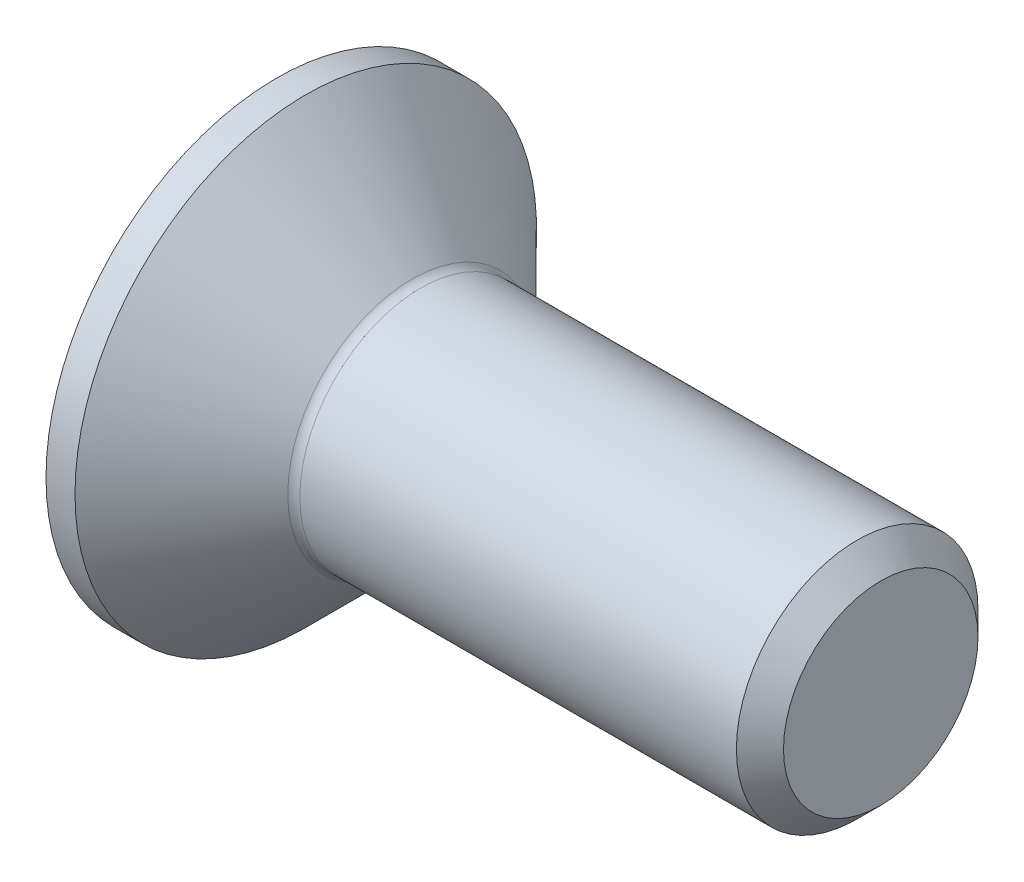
SolidWorks part; units mm, degrees
revolve "PreBroach" cut sketch "Sketch2"
sketch "Sketch2"
  line L0 (0, 1.26) -> (1.8, 1.26)
  line L1 (1.8, 1.26) -> (2.5275, 0)
  line L2 (0, 0) -> (127, 0) construction
  line L3 (2.5275, 0) -> (0, 0)
  line L4 (0, 0) -> (0, 1.26)
  line L5 (0, -1.26) -> (1.8, -1.26) construction
  line L6 (0, 0) -> (47.625, 0) construction
  line L8 (0, 3.82) -> (0, -3.82) construction
revolve "BaseBody" add sketch "BodySke" angle 360 about L6
sketch "BodySke" plane through (0, 0, 0) normal (0, 0, 1) x (1, 0, 0)
  line L0 (0, 0) -> (0, 3.82)
  line L1 (0.48, 3.82) -> (2.3, 2)
  line L2 (0, 3.82) -> (0.48, 3.82)
  line L3 (2.3, 2) -> (9.61, 2)
  line L4 (10, 1.61) -> (10, 0)
  line L5 (10, 0) -> (0, 0)
  line L6 (0, 0) -> (127, 0) construction
  line L7 (0.48, -3.82) -> (2.3, -2) construction
  line L8 (10, 1.61) -> (9.61, 2)
  line L9 (0, -3.82) -> (0.48, -3.82) construction
  line L10 (10, -1.61) -> (9.61, -2) construction
  line L11 (3, 8.35) -> (3, -13.875) construction
  line L12 (0, 16.35) -> (0, -5.875) construction
ref_plane "Plane1" through (0, 0, 0) normal (0, 0, 1) x (1, 0, 0)
ref_plane "Plane2" through (0, 0, 0) normal (0, 1, 0) x (1, 0, 0)
ref_plane "Plane3" through (0, 0, 0) normal (1, 0, 0) x (0, 0, -1)
fillet "Fillet1" radius 0.2 1 edges at (2.3, 0, 2)
sketch "Sketch3" plane through (0, 0, 0) normal (-1, 0, 0) x (0, 0, 1)
  line L0 (-1.26, -0.7275) -> (-1.26, 0.7275)
  line L1 (-1.26, 0.7275) -> (0, 1.4549)
  line L2 (0, 1.4549) -> (1.26, 0.7275)
  line L3 (1.26, 0.7275) -> (1.26, -0.7275)
  line L4 (1.26, -0.7275) -> (0, -1.4549)
  line L5 (0, -1.4549) -> (-1.26, -0.7275)
extrude "Hex" cut sketch "Sketch3" against normal blind 1.8
sketch "ThdSchSke" plane through (0, 0, 0) normal (0, 0, 1) x (1, 0, 0)
  line L0 (3.35, -1.61) -> (3.0769, -2)
  line L1 (3.35, -1.61) -> (3.6231, -2)
  line L2 (3.6231, -2) -> (3.6231, -2.5)
  line L3 (-3.175, 0) -> (5.1513, 0) construction
  line L4 (0, 3.82) -> (0, -3.82) construction
  line L5 (3.6231, -2.5) -> (3.0769, -2.5)
  line L6 (3.0769, -2.5) -> (3.0769, -2)
revolve "ThreadSchematic" [suppressed] cut sketch "ThdSchSke" angle 360 about L3
pattern_linear "ThdSchPat" [suppressed]
equation "\"Thread_minor@ThreadCosmetic\"  =  \"Minor_dia@BodySke\""
equation "\"D1@Sketch3\" = \"Hex_size@Sketch3\" / 2"
equation "\"D2@Sketch3\" = \"D1@Sketch3\""
equation "\"D3@Sketch3\" = \"Hex_size@Sketch3\""
equation "\"Thread_length@ThreadCosmetic\" = ((sgn( (\"Length@BodySke\" - \"Advance@BodySke\" * 1.5 - \"Head_ht@BodySke\" ) - \"Thread_nom@BodySke\" )-1)*( (\"Length@BodySke\" - \"Advance@BodySke\" * 1.5 - \"Head_ht@BodySke\" "
equation "\"Thread_minor@ThdSchSke\" = \"Minor_dia@BodySke\""
equation "\"Diameter@ThdSchSke\" = \"Diameter@BodySke\""
equation "\"Overcut@ThdSchSke\" = \"Diameter@BodySke\" * 1.25"
equation "\"Start@ThdSchSke\" = 0.000001 + \"Length@BodySke\" - \"Thread_length@ThreadCosmetic\"  '---Countersunk---"
equation "\"Num_threads@ThdSchPat\" = int( \"Thread_length@ThreadCosmetic\" / \"Advance@BodySke\" + 0.999 )  + 1"
equation "\"Advance@ThdSchPat\" = \"Thread_length@ThreadCosmetic\" /  (\"Num_threads@ThdSchPat\" - 1) 'relax it"
equation "\"Num_threads@ThdSchPat\" = \"Num_threads@ThdSchPat\" - sgn( \"Num_threads@ThdSchPat\" - 1) '---chamfered tips only---"
